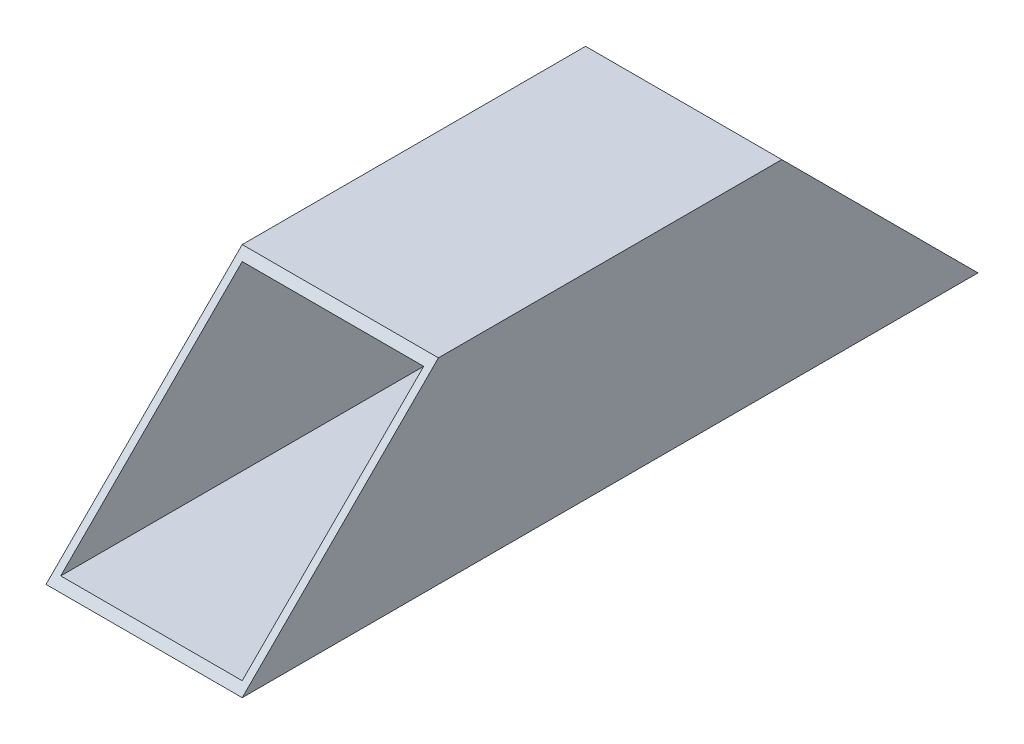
SolidWorks part; units mm, degrees
ref_plane "Plan de face" through (0, 0, 0) normal (0, 0, 1) x (1, 0, 0)
ref_plane "Plan de dessus" through (0, 0, 0) normal (0, 1, 0) x (1, 0, 0)
ref_plane "Plan de droite" through (0, 0, 0) normal (1, 0, 0) x (0, 0, -1)
sketch "Esquisse1" plane through (0, 0, 0) normal (0, 0, 1) x (1, 0, 0)
  line L1 (0, 80) -> (80, 80)
  line L2 (0, 80) -> (0, 0)
  line L3 (0, 0) -> (80, 0)
  line L4 (80, 80) -> (80, 0)
  line L5 (3, 77) -> (77, 77)
  line L6 (3, 77) -> (3, 3)
  line L7 (3, 3) -> (77, 3)
  line L8 (77, 77) -> (77, 3)
  dimension "D1" = 80
  dimension "D2" = 80
  dimension "D3" = 3
  dimension "D4" = 3
  dimension "D5" = 3
  dimension "D6" = 3
extrude "Extrusion1" add sketch "Esquisse1" along normal blind 300
chamfer "Chanfrein1" distance 80 distance2 80 1 edges at (40, 80, 300)
chamfer "Chanfrein2" distance 80 1 edges at (40, 80, 0)
